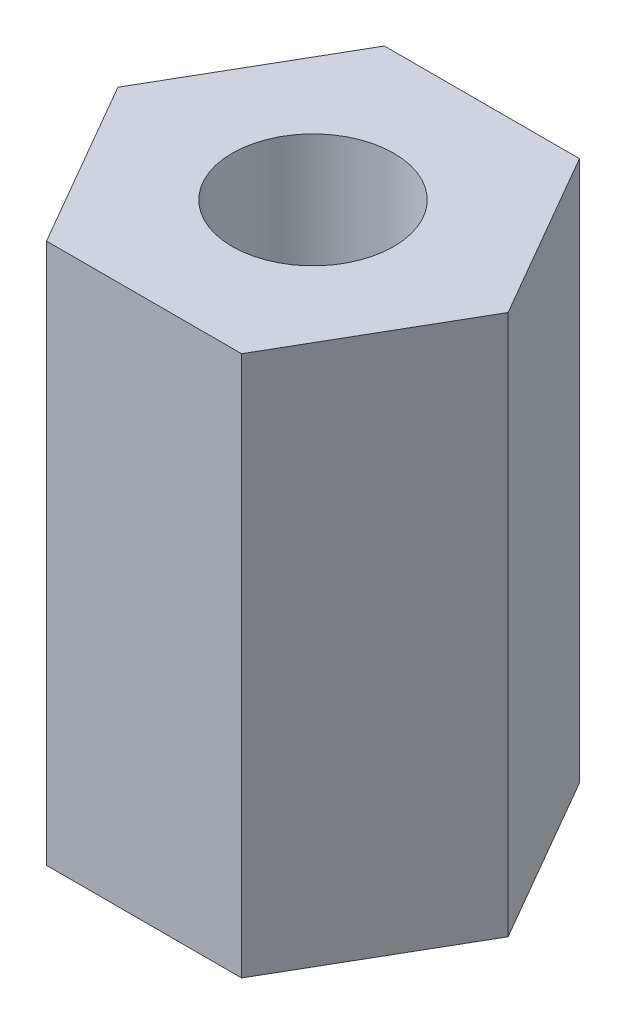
SolidWorks part; units mm, degrees
ref_plane "Front Plane" through (0, 0, 0) normal (0, 0, 1) x (1, 0, 0)
ref_plane "Top Plane" through (0, 0, 0) normal (0, 1, 0) x (1, 0, 0)
ref_plane "Right Plane" through (0, 0, 0) normal (1, 0, 0) x (0, 0, -1)
sketch "Sketch1" plane through (0, 0, 0) normal (0, 1, 0) x (1, 0, 0)
  line L0 (-2.2914, 3.9688) -> (2.2914, 3.9688)
  line L1 (2.2914, 3.9688) -> (4.5827, 0)
  line L2 (4.5827, 0) -> (2.2914, -3.9688)
  line L3 (2.2914, -3.9688) -> (-2.2914, -3.9688)
  line L4 (-2.2914, -3.9688) -> (-4.5827, 0)
  line L5 (-4.5827, 0) -> (-2.2914, 3.9688)
  line L6 (-2.2914, 3.9688) -> (2.2914, -3.9688) construction
  line L7 (-2.2914, -3.9688) -> (2.2914, 3.9688) construction
  line L8 (-4.5827, 0) -> (4.5827, 0) construction
  dimension "D1" = 7.9375
  dimension "D2" = 7.9375
extrude "Boss-Extrude1" add sketch "Sketch1" along normal blind 12.7
hole_wizard "#6 Clearance Hole1" positions "Sketch3" profile "Sketch2" hole size "#6" standard "ANSI Inch"
sketch "Sketch3" plane through (0, 12.7, 0) normal (0, 1, 0) x (1, 0, 0)
  point P0 (0, 0)
sketch "Sketch2" plane through (0, 12.7, 0) normal (1, 0, 0) x (0, 0, 1)
  line L0 (0, 0) -> (0, 12.7)
  line L1 (0, 12.7) -> (1.8986, 12.7)
  line L2 (1.8986, 12.7) -> (1.8986, 0)
  line L5 (1.8986, 0) -> (0, 0)
  line L11 (0, -6.35) -> (0, 107.95) construction
  dimension "Thru Hole Dia." = 3.7973
  dimension "Thru Hole Depth" = 12.7
